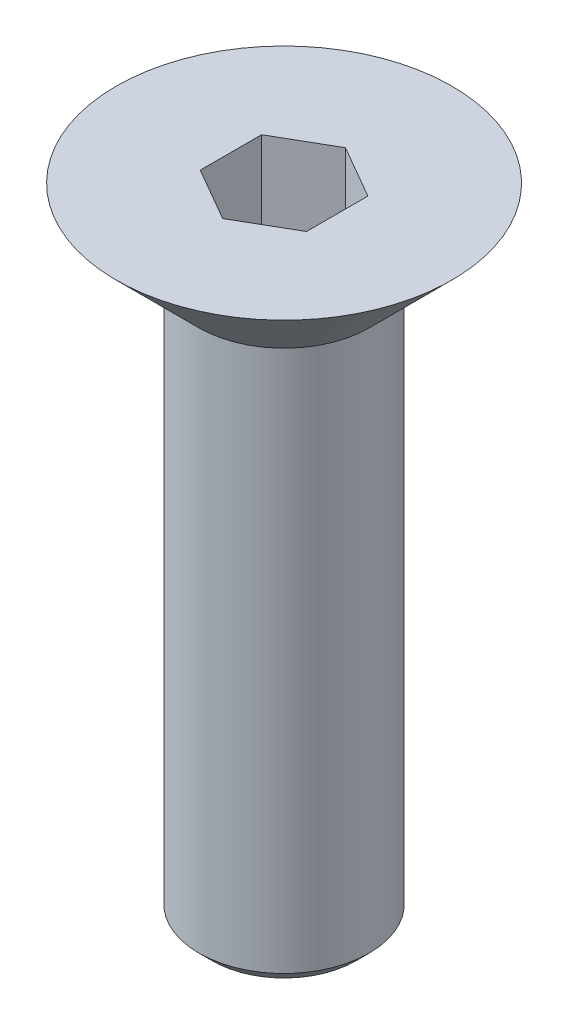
SolidWorks part; units mm, degrees
ref_plane "Face" through (0, 0, 0) normal (0, 0, 1) x (1, 0, 0)
ref_plane "Dessus" through (0, 0, 0) normal (0, 1, 0) x (1, 0, 0)
ref_plane "Droite" through (0, 0, 0) normal (1, 0, 0) x (0, 0, -1)
revolve "corps" add sketch "E_corps"
sketch "E_corps" plane through (0, 0, 0) normal (0, 0, 1) x (1, 0, 0)
  line L0 (0, 65.1173) -> (0, -30) construction
  line L1 (0, 0) -> (7.9, 0)
  line L2 (7.9, 0) -> (4, -3.9)
  line L3 (4, -3.9) -> (4, -30)
  line L4 (4, -30) -> (0, -30)
  line L5 (0, -30) -> (0, 0)
  line L7 (50, 0) -> (-50, 0) construction
  dimension "Diamètre_nominal" = 8
  dimension "Diamètre_de_tête" = 15.8
  dimension "D1" = 45
  dimension "D2" = 3.9
  dimension "Longueur_sous_tête" = 30
chamfer "Chanfrein1" distance 0.625 angle 45 1 edges at (-4, -30, 0)
sketch "E_6_pans_creux" plane through (0, 0, 0) normal (0, 1, 0) x (-1, 0, 0)
  line L0 (0, 6.3383) -> (0, -7.3536) construction
  line L1 (0, 2.8868) -> (2.5, 1.4434)
  line L2 (0, 2.8868) -> (-2.5, 1.4434)
  line L3 (2.5, 1.4434) -> (2.5, -1.4434)
  line L4 (-2.5, 1.4434) -> (-2.5, -1.4434)
  line L5 (2.5, -1.4434) -> (0, -2.8868)
  line L6 (-2.5, -1.4434) -> (0, -2.8868)
  circle A0 centre (0, 0) radius 2.8868 construction
  dimension "a" = 5
extrude "Empreinte_6_pans_creux" cut sketch "E_6_pans_creux" against normal blind 7.2
equation "\"profondeur@Empreinte_6_pans_creux\" = 0.9*\"Diamètre_nominal@E_corps\""
equation "\"D1@Représentation de filetage1\" = \"Longueur_sous_tête@E_corps\" - \"D2@E_corps\""
